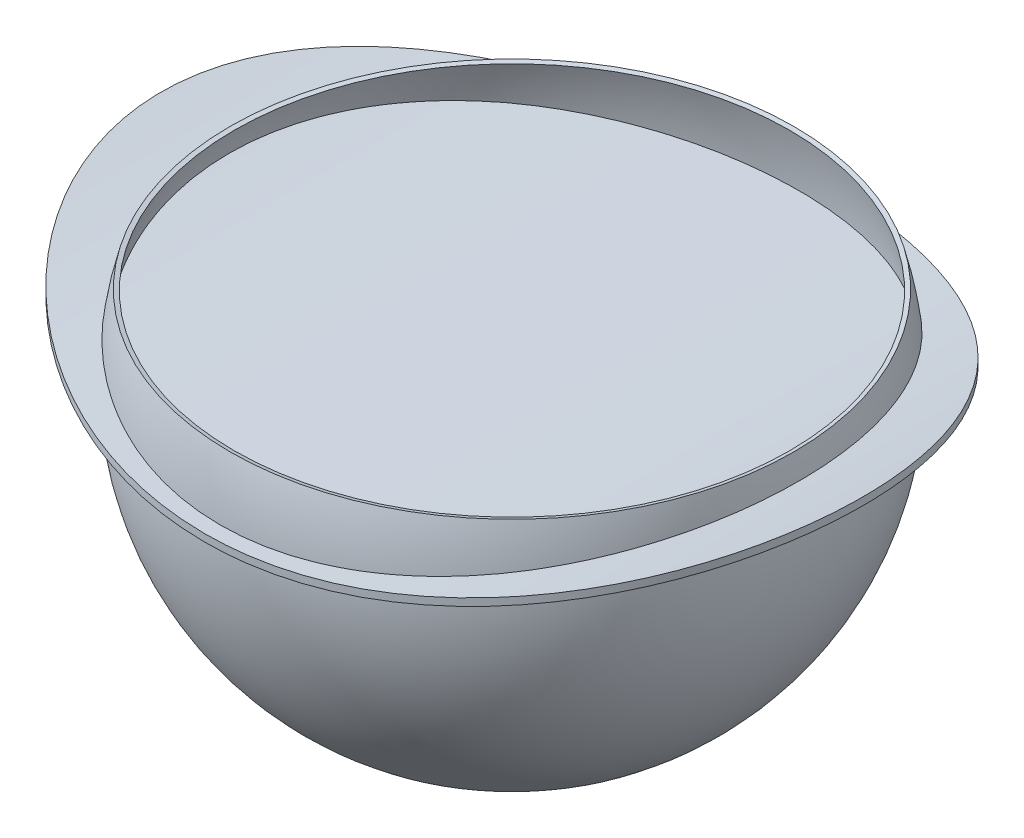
SolidWorks part; units mm, degrees
other "Bowl"
other "Bowl Lip"
ref_plane "Front Plane" through (0, 0, 0) normal (0, 0, 1) x (1, 0, 0)
ref_plane "Top Plane" through (0, 0, 0) normal (0, 1, 0) x (1, 0, 0)
ref_plane "Right Plane" through (0, 0, 0) normal (1, 0, 0) x (0, 0, -1)
sketch "Sketch1" plane through (0, 0, 0) normal (1, 0, 0) x (0, 0, -1)
  line L0 (0, 0) -> (0, 83.5165) construction
  line L1 (0, 0) -> (55, 0)
  arc A0 (55, 0) -> (96.4294, 110) centre (0, 83.5165) ccw
  dimension "D2" = 100
  dimension "D1" = 110
  dimension "D3" = 110
revolve "Revolve-Thin1" add sketch "Sketch1" angle 360 about L0
sketch "Sketch2" plane through (0, 0, 0) normal (0, 0, 1) x (1, 0, 0)
  line L0 (0, 0) -> (0, 90) construction
  arc A0 (-120, 108.4243) -> (120, 108.4243) centre (0, 490) ccw
  dimension "D1" = 400
  dimension "D2" = 90
  dimension "D3" = 240
extrude "Extrude-Thin1" add sketch "Sketch2" along normal mid plane 210 separate body thin
sketch "Sketch3" plane through (0, 0, 0) normal (0, 1, 0) x (1, 0, 0)
  line L2 (120, 105) -> (-120, 105) construction
  line L3 (120, -105) -> (120, 105) construction
  ellipse E0 centre (0, 0) end of major axis (-120, 0) minor radius 105
extrude "Cut-Extrude1" cut sketch "Sketch3" along normal through all flip side to cut
